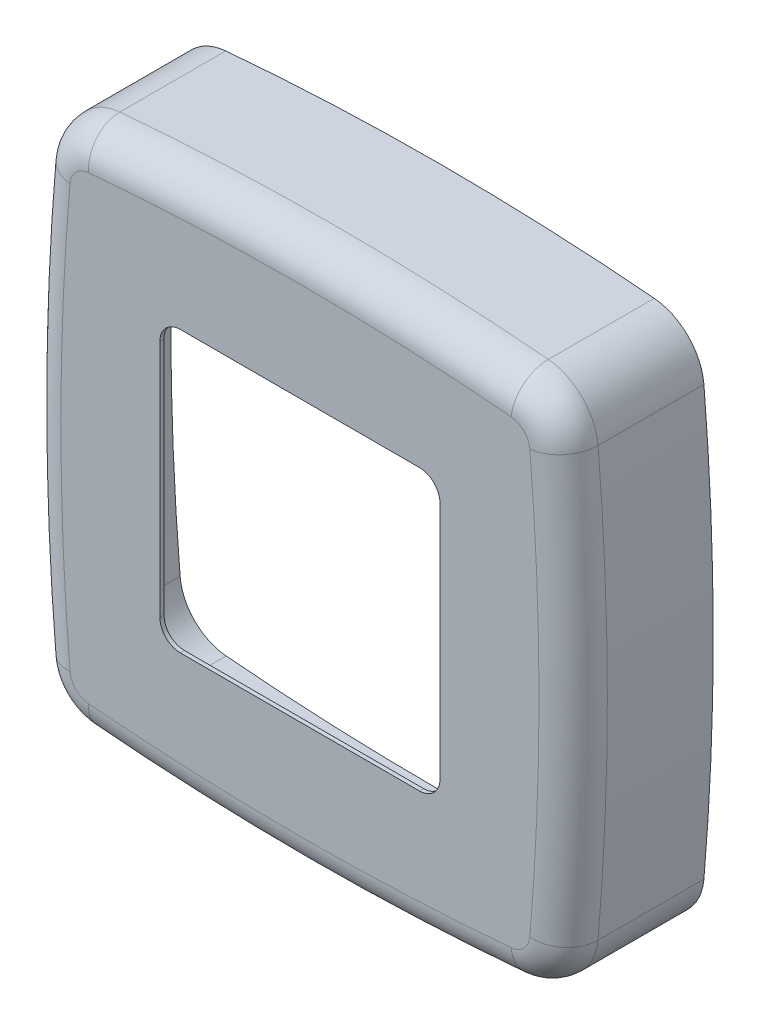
SolidWorks part; units mm, degrees
ref_plane "Plano frontal" through (0, 0, 0) normal (0, 0, 1) x (1, 0, 0)
ref_plane "Plano superior" through (0, 0, 0) normal (0, 1, 0) x (1, 0, 0)
ref_plane "Plano direito" through (0, 0, 0) normal (1, 0, 0) x (0, 0, -1)
imported_body "Importado1"
sketch "Esboço1" plane through (0, 0, -8.75) normal (0, 0, -1) x (-1, 0, 0)
  arc A0 (31.3101, 38.0412) -> (-31.3101, 38.0412) centre (0, -322) ccw construction
  arc A1 (-31.3101, 38.0412) -> (-38.0412, 31.3101) centre (-30.669, 30.669) ccw construction
  arc A2 (-38.0412, 31.3101) -> (-38.0412, -31.3101) centre (322, 0) ccw construction
  arc A3 (-38.0412, -31.3101) -> (-31.3101, -38.0412) centre (-30.669, -30.669) ccw construction
  arc A4 (-31.3101, -38.0412) -> (31.3101, -38.0412) centre (0, 322) ccw construction
  arc A5 (31.3101, -38.0412) -> (38.0412, -31.3101) centre (30.669, -30.669) ccw construction
  arc A6 (38.0412, -31.3101) -> (38.0412, 31.3101) centre (-322, 0) ccw construction
  arc A7 (38.0412, 31.3101) -> (31.3101, 38.0412) centre (30.669, 30.669) ccw construction
  arc A8 (38.6389, -31.3621) -> (38.6389, 31.3621) centre (-322, 0) ccw
  arc A9 (38.6389, 31.3621) -> (31.3621, 38.6389) centre (30.669, 30.669) ccw
  arc A10 (31.3621, 38.6389) -> (-31.3621, 38.6389) centre (0, -322) ccw
  arc A11 (-31.3621, 38.6389) -> (-38.6389, 31.3621) centre (-30.669, 30.669) ccw
  arc A12 (-38.6389, 31.3621) -> (-38.6389, -31.3621) centre (322, 0) ccw
  arc A13 (-38.6389, -31.3621) -> (-31.3621, -38.6389) centre (-30.669, -30.669) ccw
  arc A14 (-31.3621, -38.6389) -> (31.3621, -38.6389) centre (0, 322) ccw
  arc A15 (31.3621, -38.6389) -> (38.6389, -31.3621) centre (30.669, -30.669) ccw
  arc A16 (38.6389, -31.3621) -> (38.6389, 31.3621) centre (-322, 0) ccw
  arc A17 (38.6389, 31.3621) -> (31.3621, 38.6389) centre (30.669, 30.669) ccw
  arc A18 (31.3621, 38.6389) -> (-31.3621, 38.6389) centre (0, -322) ccw
  arc A19 (-31.3621, 38.6389) -> (-38.6389, 31.3621) centre (-30.669, 30.669) ccw
  arc A20 (-38.6389, 31.3621) -> (-38.6389, -31.3621) centre (322, 0) ccw
  arc A21 (-38.6389, -31.3621) -> (-31.3621, -38.6389) centre (-30.669, -30.669) ccw
  arc A22 (-31.3621, -38.6389) -> (31.3621, -38.6389) centre (0, 322) ccw
  arc A23 (31.3621, -38.6389) -> (38.6389, -31.3621) centre (30.669, -30.669) ccw
  arc A24 (31.3101, 38.0412) -> (-31.3101, 38.0412) centre (0, -322) ccw
  arc A25 (-31.3101, 38.0412) -> (-38.0412, 31.3101) centre (-30.669, 30.669) ccw
  arc A26 (-38.0412, 31.3101) -> (-38.0412, -31.3101) centre (322, 0) ccw
  arc A27 (-38.0412, -31.3101) -> (-31.3101, -38.0412) centre (-30.669, -30.669) ccw
  arc A28 (-31.3101, -38.0412) -> (31.3101, -38.0412) centre (0, 322) ccw
  arc A29 (31.3101, -38.0412) -> (38.0412, -31.3101) centre (30.669, -30.669) ccw
  arc A30 (38.0412, -31.3101) -> (38.0412, 31.3101) centre (-322, 0) ccw
  arc A31 (38.0412, 31.3101) -> (31.3101, 38.0412) centre (30.669, 30.669) ccw
  dimension "D1" = 0
extrude "Ressalto-extrusão1" add sketch "Esboço1" along normal blind 3
